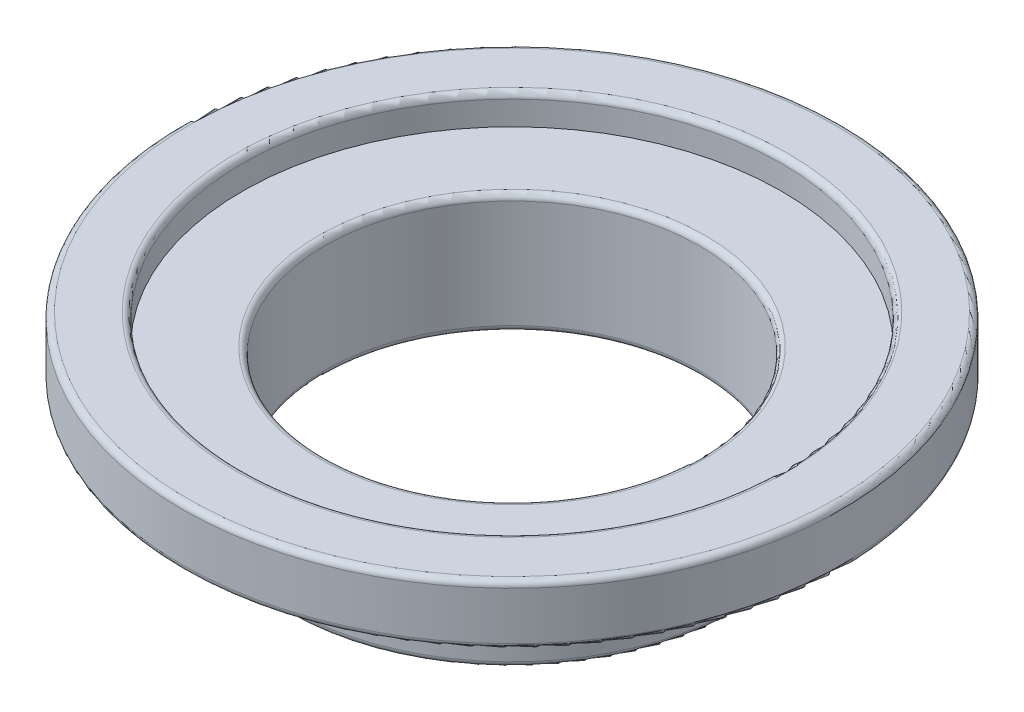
SolidWorks part; units mm, degrees
ref_plane "Front Plane" through (0, 0, 0) normal (0, 0, 1) x (1, 0, 0)
ref_plane "Top Plane" through (0, 0, 0) normal (0, 1, 0) x (1, 0, 0)
ref_plane "Right Plane" through (0, 0, 0) normal (1, 0, 0) x (0, 0, -1)
sketch "Sketch1" plane through (0, 0, 0) normal (1, 0, 0) x (0, 0, -1)
  line L0 (-7.5, 5.255) -> (-6.25, 5.255)
  line L1 (-6.25, 5.255) -> (-6.25, 9.255)
  line L2 (-6.25, 9.255) -> (-9, 9.255)
  line L3 (-9, 9.255) -> (-9, 10.255)
  line L4 (-9, 10.255) -> (-11, 10.255)
  line L5 (-11, 10.255) -> (-11, 8.255)
  line L6 (-11, 8.255) -> (-7.5, 8.255)
  line L7 (-7.5, 8.255) -> (-7.5, 5.255)
  line L8 (0, 0) -> (0, 12.255) construction
  dimension "D1" = 12.5
  dimension "D2" = 15
  dimension "D3" = 18
  dimension "D4" = 22
  dimension "D5" = 3
  dimension "D6" = 4
  dimension "D7" = 5
revolve "Revolve1" add sketch "Sketch1" angle 360 about L8
fillet "Fillet1" radius 0.2 6 edges at (0, 10.255, -9) (0, 9.255, -6.25) (0, 5.255, -6.25) (0, 5.255, -7.5) (0, 10.255, -11) (0, 8.255, -11)
